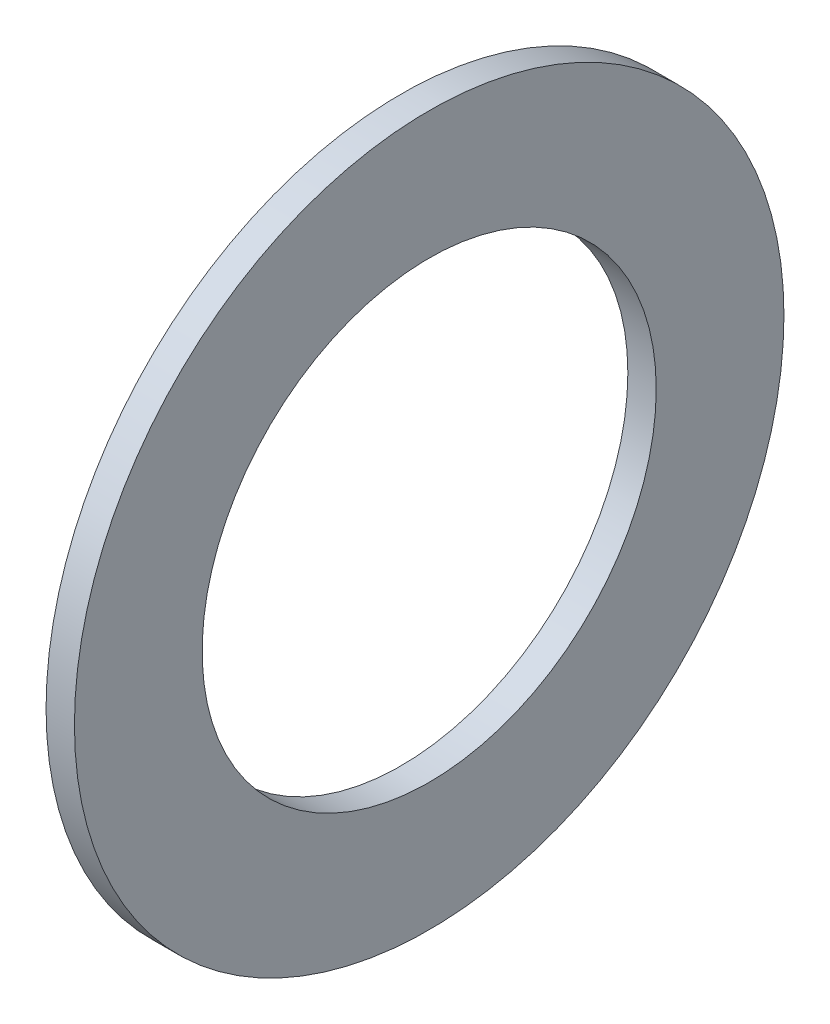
SolidWorks part; units mm, degrees
ref_plane "Front Plane" through (0, 0, 0) normal (0, 0, 1) x (1, 0, 0)
ref_plane "Top Plane" through (0, 0, 0) normal (0, 1, 0) x (1, 0, 0)
ref_plane "Right Plane" through (0, 0, 0) normal (1, 0, 0) x (0, 0, -1)
sketch "Sketch1" plane through (0, 0, 0) normal (1, 0, 0) x (0, 0, -1)
  circle A0 centre (0, 0) radius 1.6
  circle A1 centre (0, 0) radius 2.5
  dimension "D1" = 3.2
  dimension "D2" = 5
extrude "Boss-Extrude1" add sketch "Sketch1" along normal blind 0.2
